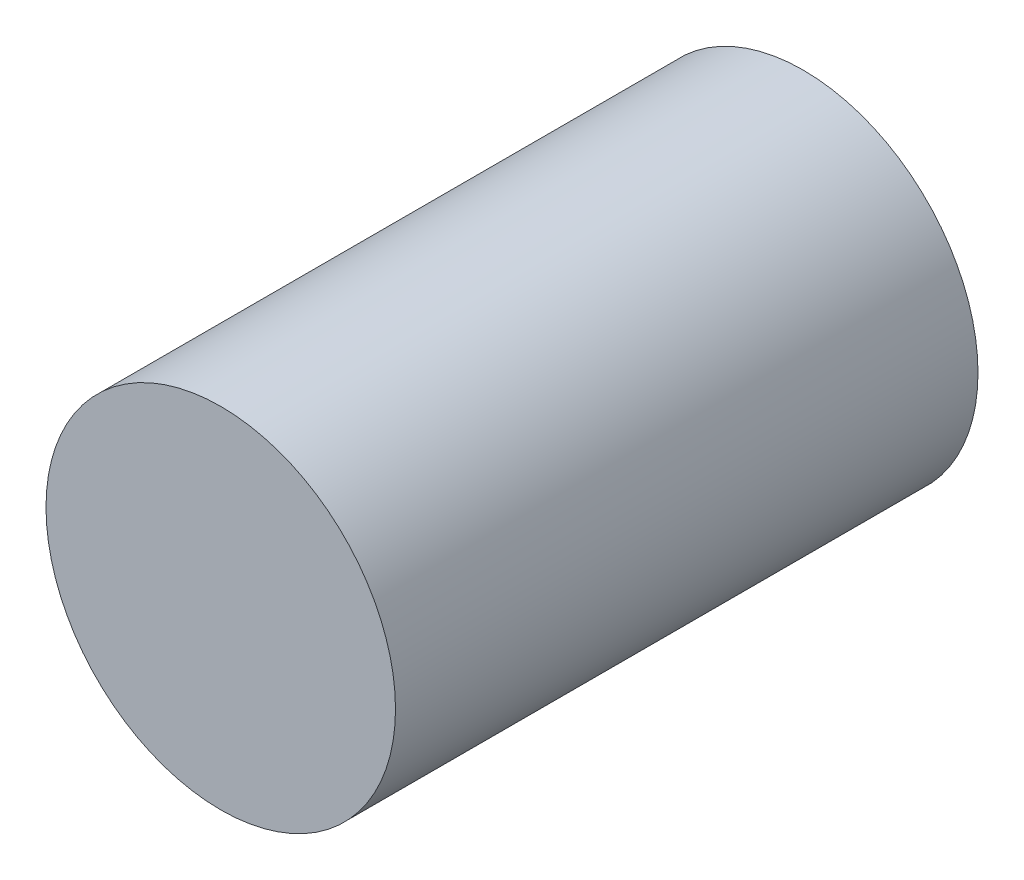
SolidWorks part; units mm, degrees
ref_plane "Plan de face" through (0, 0, 0) normal (0, 0, 1) x (1, 0, 0)
ref_plane "Plan de dessus" through (0, 0, 0) normal (0, 1, 0) x (1, 0, 0)
ref_plane "Plan de droite" through (0, 0, 0) normal (1, 0, 0) x (0, 0, -1)
sketch "Esquisse1" plane through (0, 0, 0) normal (0, 0, 1) x (1, 0, 0)
  circle A0 centre (0, 0) radius 3
  dimension "D2" = 6
extrude "Boss.-Extru.1" add sketch "Esquisse1" along normal blind 10
